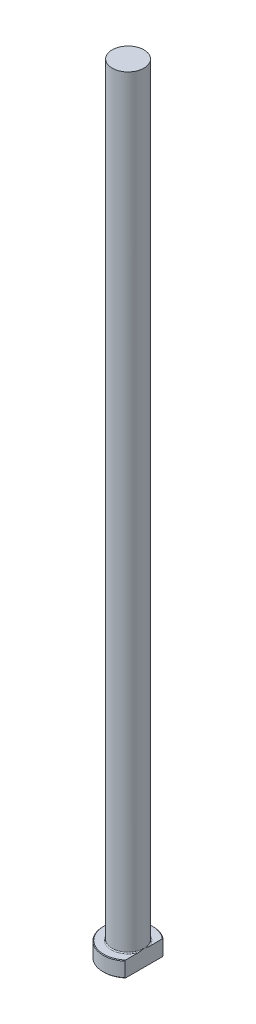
SolidWorks part; units mm, degrees
ref_plane "Front Plane" through (0, 0, 0) normal (0, 0, 1) x (1, 0, 0)
ref_plane "Top Plane" through (0, 0, 0) normal (0, 1, 0) x (1, 0, 0)
ref_plane "Right Plane" through (0, 0, 0) normal (1, 0, 0) x (0, 0, -1)
sketch "Sketch1" plane through (0, 0, 0) normal (0, 0, 1) x (1, 0, 0)
  line L0 (0, 259.9588) -> (0, -15.1925) construction
  line L1 (0, 0) -> (-8, 0)
  line L2 (-8, 0) -> (-8, 5)
  line L3 (-8, 5) -> (-5.1, 5)
  line L4 (-5.1, 5) -> (-5.1, 250)
  line L5 (-5.1, 250) -> (0, 250)
  line L6 (0, 250) -> (0, 0)
  dimension "L" = 250
  dimension "H" = 16
  dimension "T" = 5
  dimension "D" = 10.2
revolve "Revolve1" add sketch "Sketch1" angle 360 about L0
chamfer "Chamfer1" distance 0.2 angle 45 2 edges at (0, 5, 8) (0, 0, 8)
fillet "Fillet1" radius 0.3 1 edges at (0, 5, 5.1)
sketch "Sketch2" plane through (0, 0, 0) normal (0, 1, 0) x (1, 0, 0)
  line L0 (5.1, 6.1636) -> (5.1, -6.1636)
  circle A0 centre (0, 0) radius 8 construction
  arc A1 (5.1, -6.1636) -> (5.1, 6.1636) centre (0, 0) ccw
  circle A2 centre (0, 0) radius 5.1 construction
extrude "KEY" cut sketch "Sketch2" along normal through all
